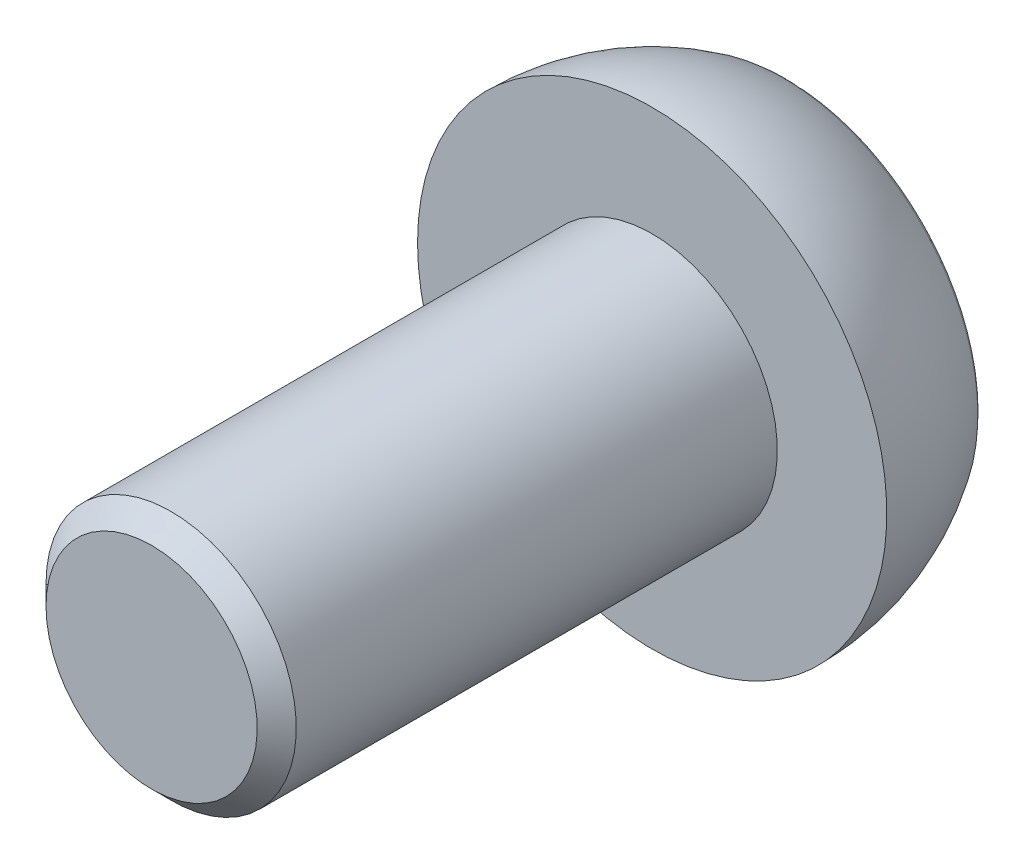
SolidWorks part; units mm, degrees
ref_plane "Face" through (0, 0, 0) normal (0, 0, 1) x (1, 0, 0)
ref_plane "Dessus" through (0, 0, 0) normal (0, 1, 0) x (1, 0, 0)
ref_plane "Droite" through (0, 0, 0) normal (1, 0, 0) x (0, 0, -1)
imported_body "Importée1"
sketch "Esquisse1" plane through (0, 0, -19) normal (0, 0, 1) x (1, 0, 0)
  circle A0 centre (60.6999, 219.3355) radius 4 construction
  circle A1 centre (60.6999, 219.3355) radius 4
extrude "Extrusion1" add sketch "Esquisse1" against normal blind 2
chamfer "Chanfrein1" distance 0.625 angle 45
